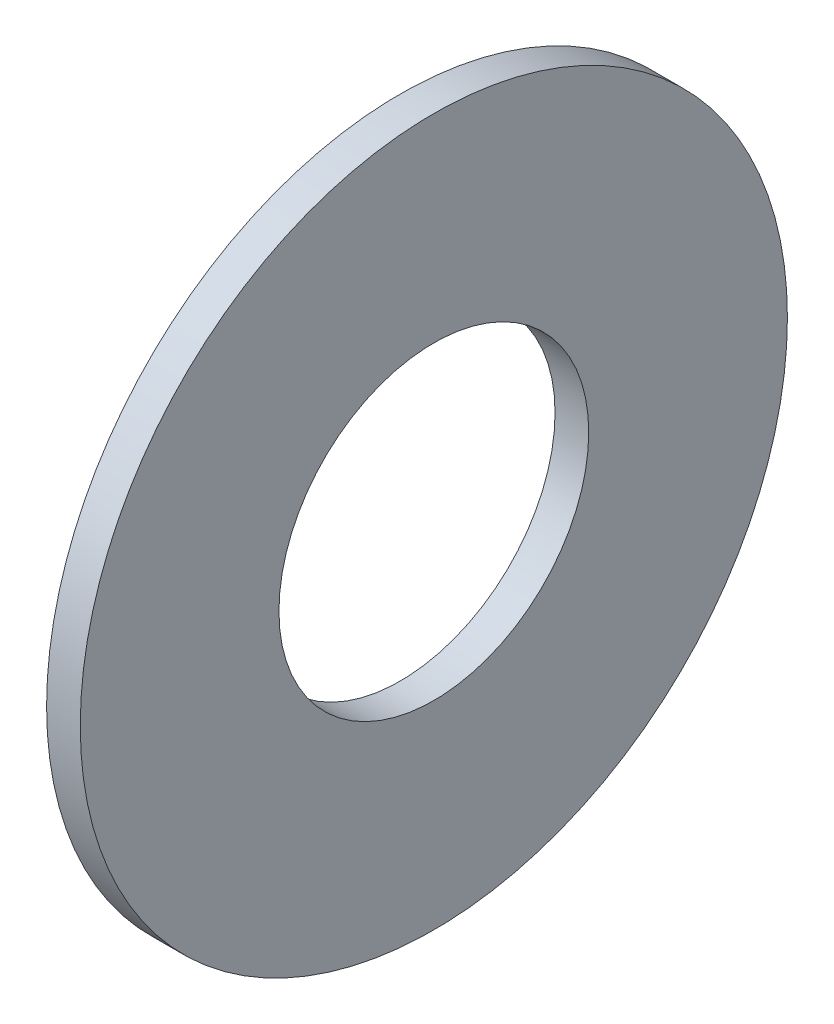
SolidWorks part; units mm, degrees
ref_plane "Plane1" through (0, 0, 0) normal (0, 0, 1) x (1, 0, 0)
ref_plane "Plane2" through (0, 0, 0) normal (0, 1, 0) x (1, 0, 0)
ref_plane "Plane3" through (0, 0, 0) normal (1, 0, 0) x (0, 0, -1)
other "Configuration Table"
sketch "Sketch1" plane through (0, 0, 0) normal (1, 0, 0) x (0, 0, -1)
  circle A0 centre (0, 0) radius 4.6
  circle A1 centre (0, 0) radius 10.5
  dimension "Insid_Dia" = 9.2
  dimension "OutsideDia" = 21
extrude "Base-Extrude" add sketch "Sketch1" along normal blind 1
